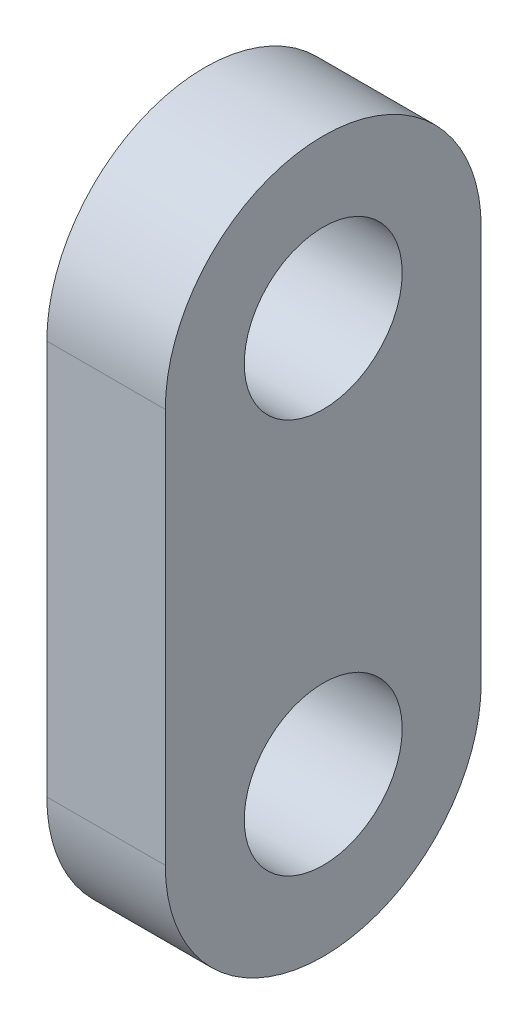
SolidWorks part; units mm, degrees
ref_plane "Front Plane" through (0, 0, 0) normal (0, 0, 1) x (1, 0, 0)
ref_plane "Top Plane" through (0, 0, 0) normal (0, 1, 0) x (1, 0, 0)
ref_plane "Right Plane" through (0, 0, 0) normal (1, 0, 0) x (0, 0, -1)
sketch "Sketch1" plane through (0, 0, 0) normal (1, 0, 0) x (0, 0, -1)
  line L0 (0, 0) -> (0, 6.5747) construction
  line L1 (4, 10) -> (4, 0)
  line L2 (-4, 10) -> (-4, 0)
  circle A0 centre (0, 0) radius 2
  circle A1 centre (0, 10) radius 2
  arc A2 (4, 10) -> (-4, 10) centre (0, 10) ccw
  arc A3 (4, 0) -> (-4, 0) centre (0, 0) cw
  dimension "D1" = 4
  dimension "D2" = 4
  dimension "D5" = 4
  dimension "D3" = 10
  dimension "D4" = 8
extrude "Boss-Extrude1" add sketch "Sketch1" along normal blind 3
